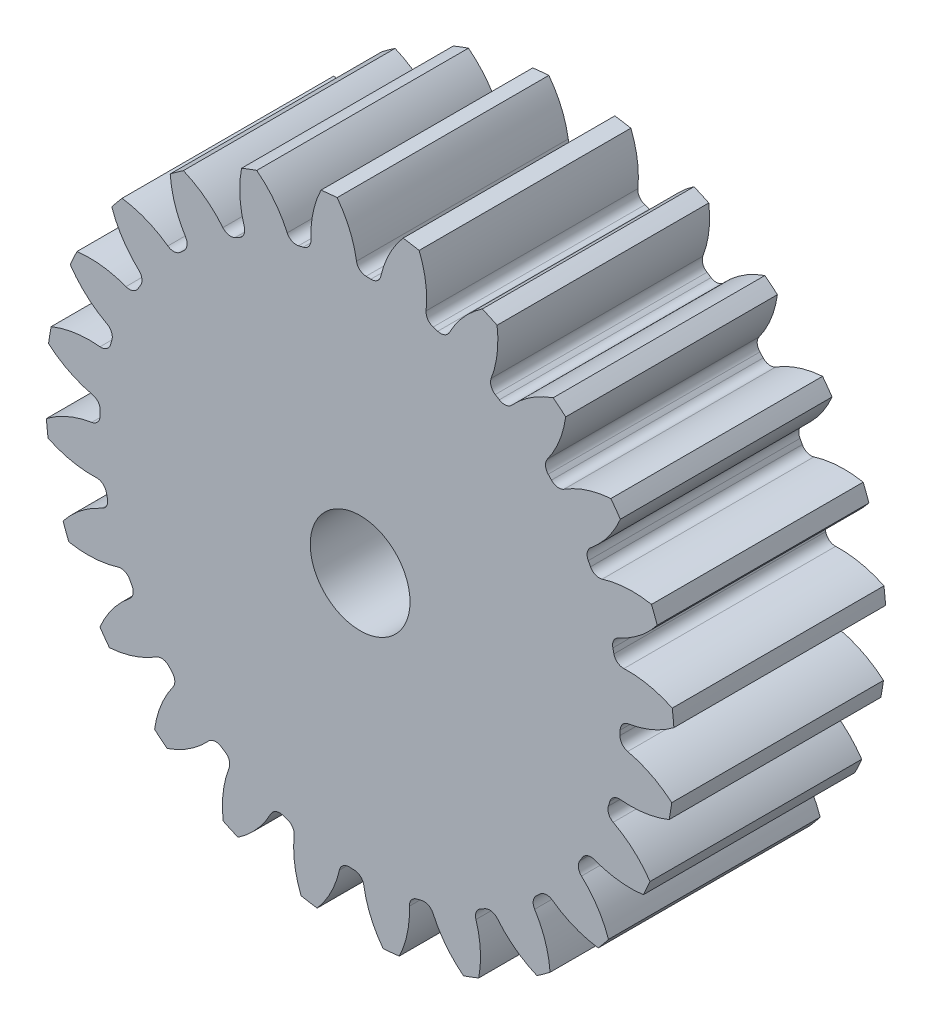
SolidWorks part; units mm, degrees
ref_plane "Front" through (0, 0, 0) normal (0, 0, 1) x (1, 0, 0)
ref_plane "Top" through (0, 0, 0) normal (0, 1, 0) x (1, 0, 0)
ref_plane "Right" through (0, 0, 0) normal (1, 0, 0) x (0, 0, -1)
sketch "Sketch3" plane through (0, 0, 0) normal (0, 0, 1) x (1, 0, 0)
  circle A0 centre (0, 0) radius 132.08
  dimension "od" = 264.16
extrude "gearBody" add sketch "Sketch3" along normal blind 88.9
sketch "Sketch2" plane through (0, 0, 0) normal (0, 0, 1) x (1, 0, 0)
  line L0 (0, 0) -> (105.8464, 43.843) construction
  line L1 (131.1772, -18.3345) -> (0, 0) construction
  line L2 (0, 0) -> (36.3143, 0) construction
  line L3 (121.8523, 4.0619) -> (121.3445, -11.8318) construction
  line L5 (121.5984, -3.885) -> (0, 0) construction
  line L7 (0, 0) -> (114.5673, 0) construction
  arc A0 (114.5523, 1.8557) -> (114.2002, -9.1641) centre (0, 0) ccw construction
  arc A1 (131.7268, 9.6534) -> (130.8419, -18.0422) centre (0, 0) ccw construction
  arc A2 (121.8523, 4.0619) -> (121.3445, -11.8318) centre (0, 0) ccw construction
  arc A3 (109.1275, -4.4953) -> (109.1918, -2.4798) centre (0, 0) ccw
  arc A4 (131.1772, -18.3345) -> (112.342, -8.6976) centre (102.8319, -50.5101) ccw
  arc A5 (131.1772, -18.3345) -> (132.08, 9.9237) centre (0, 0) ccw
  arc A6 (132.08, 9.9237) -> (112.6681, 1.5088) centre (105.8464, 43.843) cw
  arc A7 (109.1918, -2.4798) -> (112.6681, 1.5088) centre (113.3259, -2.5737) cw
  arc A8 (112.342, -8.6976) -> (109.1275, -4.4953) centre (113.2591, -4.6655) cw
  point P6 (132.08, 9.9237)
  point P22 (131.1772, -18.3345)
  dimension "baseDia" = 229.1346
  dimension "od" = 264.16
  dimension "pd" = 243.84
  dimension "rd" = 218.44
  dimension "rFillet" = 4.1351
  dimension "pointX" = 132.08
  dimension "pointY" = 9.9237
  dimension "CTT" = 15.8937
  dimension "flankCenterAngle" = 22.5
extrude "toothCut" cut sketch "Sketch2" along normal through all
pattern_circular "CirPattern1" count 24 over 360 about axis through (0, 0, 0) along (0, 0, 1) of "toothCut"
sketch "hub1Dia" plane through (0, 0, 0) normal (0, 0, -1) x (-1, 0, 0)
  circle A0 centre (0, 0) radius 12.7
  dimension "hub1Dia" = 25.4
sketch "hub2Dia" plane through (0, 0, 88.9) normal (0, 0, 1) x (1, 0, 0)
  circle A0 centre (0, 0) radius 12.7
  dimension "hub2dia" = 25.4
sketch "boreDia" plane through (0, 0, 0) normal (0, 0, 1) x (1, 0, 0)
  circle A0 centre (0, 0) radius 20.955
  dimension "boreDia" = 41.91
extrude "bore" cut sketch "boreDia" against normal mid plane 25400
